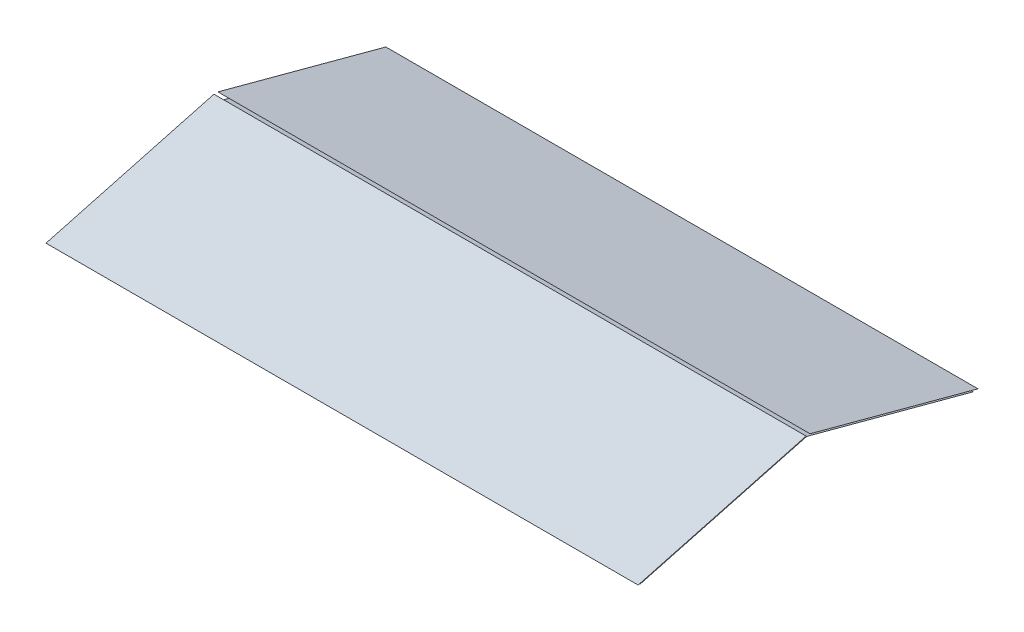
SolidWorks part; units mm, degrees
ref_plane "Front" through (0, 0, 0) normal (0, 0, 1) x (1, 0, 0)
ref_plane "Base Plane" through (0, 0, 0) normal (0, 1, 0) x (1, 0, 0)
ref_plane "Back Plane" through (0, 0, 0) normal (1, 0, 0) x (0, 0, -1)
other "Configuration Table"
sketch "Points Sketch" plane through (0, 0, 0) normal (0, 1, 0) x (1, 0, 0)
  point P0 (0, 0)
  point P3 (21000, 3000)
  point P4 (3000, 0)
  point P5 (21000, 9000)
  point P6 (6000, 0)
  point P7 (9000, 0)
  point P8 (12000, 0)
  point P9 (15000, 0)
  point P10 (18000, 0)
  point P11 (21000, 0)
  point P12 (6000, 3000)
  point P13 (9000, 3000)
  point P14 (12000, 3000)
  point P15 (15000, 3000)
  point P16 (18000, 3000)
  point P17 (3000, 9000)
  point P19 (3000, 6000)
  point P20 (6000, 6000)
  point P21 (9000, 6000)
  point P23 (12000, 6000)
  point P24 (15000, 6000)
  point P25 (18000, 6000)
  point P26 (21000, 6000)
  point P27 (6000, 9000)
  point P28 (9000, 9000)
  point P29 (12000, 9000)
  point P30 (15000, 9000)
  point P31 (18000, 9000)
  point P32 (0, 3000)
  point P35 (0, 6000)
  point P37 (0, 12000)
  point P38 (3000, 12000)
  point P39 (6000, 12000)
  point P40 (9000, 12000)
  point P41 (12000, 12000)
  point P42 (15000, 12000)
  point P43 (18000, 12000)
  point P44 (21000, 12000)
  point P45 (3000, 3000)
  point P46 (0, 9000)
  dimension "D1" = 8
  dimension "D2" = 5
  dimension "D3" = 6000
  dimension "D4" = 3000
ref_plane "Front plane" through (21000, 0, 0) normal (1, 0, 0) x (0, 0, -1)
sketch "Sketch15" plane through (0, 0, 0) normal (1, 0, 0) x (0, 0, -1)
  line L0 (0, 3500) -> (6000, 5107.6952)
  line L1 (6000, 5107.6952) -> (12000, 3500)
  line L2 (6000, 1650) -> (6000, -1650) construction
  line L3 (0, 50) -> (0, -50) construction
  dimension "D1" = 75
surface "Roof Surface 1" sketch "Sketch15"
sketch "Sketch124" plane through (21000, 0, 0) normal (1, 0, 0) x (0, 0, -1)
  line L0 (6000, 1650) -> (6000, -1650) construction
  line L1 (-120, 3557.977) -> (-120, 0) construction
  line L2 (-120, 3557.977) -> (5880, 5167.6952)
  line L3 (5880, 5214.4961) -> (5880, 5056.8765) construction
  line L4 (12120, 3557.977) -> (6120, 5167.6952)
  line L5 (6120, 5214.4961) -> (6120, 5056.8765) construction
  line L6 (5880, 5167.6952) -> (5928.2922, 5180.6513)
  line L7 (6120, 5167.6952) -> (6071.7078, 5180.6513)
  point P0 (-120, 3557.977)
  point P1 (6000, 5167.7)
  point P2 (6000, 0)
  dimension "D1" = 3560
  dimension "D2" = 5167.7
  dimension "D3" = 6120
  dimension "D4" = 120
  dimension "D5" = 120
  dimension "D6" = 60
  dimension "D7" = 60
  dimension "D8" = 50
  dimension "D9" = 50
surface "Roof Surface 2" sketch "Sketch124" parameters "D1"=21277, "D2"=50
ref_plane "Top plane" through (0, 3500, 0) normal (0, 1, 0) x (1, 0, 0)
ref_plane "Central Plane" through (0, 0, -6000) normal (0, 0, 1) x (1, 0, 0)
ref_plane "Summit Plane" through (0, 5107.6952, 0) normal (0, 1, 0) x (1, 0, 0)
sketch "Sketch3" plane through (0, 3500, 0) normal (0, 1, 0) x (1, 0, 0)
  point P0 (6000, 6000)
  point P2 (9000, 6000)
  point P4 (12000, 6000)
  point P6 (15000, 6000)
  point P8 (18000, 6000)
  point P10 (21000, 6000)
  point P12 (21000, 3000)
  point P14 (15000, 0)
  point P16 (18000, 0)
  point P18 (21000, 0)
  point P20 (12000, 0)
  point P22 (9000, 0)
  point P24 (6000, 0)
  point P26 (3000, 0)
  point P28 (0, 0)
  point P30 (0, 3000)
  point P32 (3000, 6000)
  point P34 (0, 6000)
  point P36 (0, 9000)
  point P38 (21000, 9000)
  point P40 (0, 12000)
  point P42 (3000, 12000)
  point P44 (6000, 12000)
  point P46 (9000, 12000)
  point P48 (12000, 12000)
  point P50 (15000, 12000)
  point P52 (18000, 12000)
  point P54 (21000, 12000)
ref_plane "V Intermediate Plane 1" through (18000, 0, 0) normal (1, 0, 0) x (0, 0, -1)
ref_plane "V Intermediate Plane 2" through (15000, 0, 0) normal (1, 0, 0) x (0, 0, -1)
ref_plane "V Intermediate Plane 3" through (12000, 0, 0) normal (1, 0, 0) x (0, 0, -1)
ref_plane "V Intermediate Plane 4" through (9000, 0, 0) normal (1, 0, 0) x (0, 0, -1)
ref_plane "V Intermediate Plane 5" through (6000, 0, 0) normal (1, 0, 0) x (0, 0, -1)
ref_plane "V Intermediate Plane 6" through (3000, 0, 0) normal (1, 0, 0) x (0, 0, -1)
ref_plane "H Intermediate Plane 1" through (0, 2400, 0) normal (0, 1, 0) x (1, 0, 0)
ref_plane "H Intermediate Plane 2" through (0, 1200, 0) normal (0, 1, 0) x (1, 0, 0)
